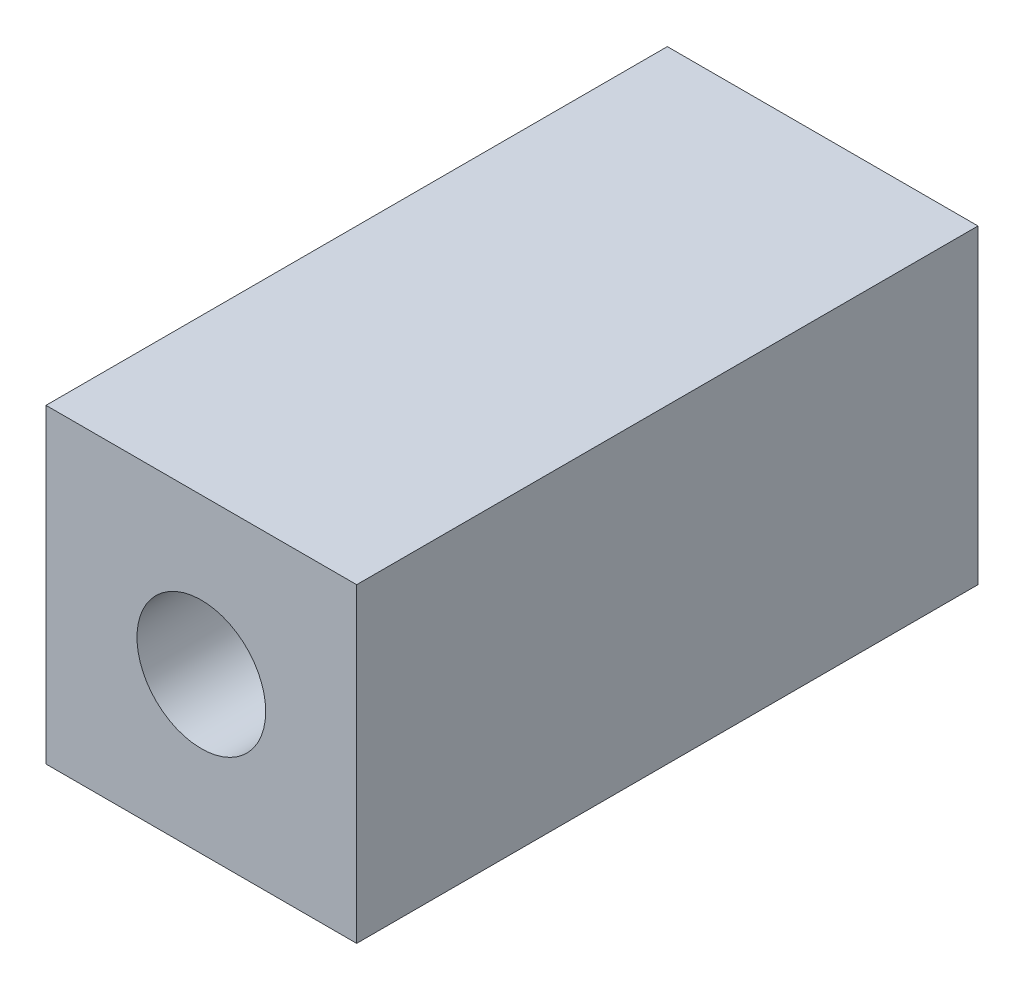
SolidWorks part; units mm, degrees
ref_plane "Plan de face" through (0, 0, 0) normal (0, 0, 1) x (1, 0, 0)
ref_plane "Plan de dessus" through (0, 0, 0) normal (0, 1, 0) x (1, 0, 0)
ref_plane "Plan de droite" through (0, 0, 0) normal (1, 0, 0) x (0, 0, -1)
sketch "Esquisse1" plane through (0, 0, 0) normal (0, 0, 1) x (1, 0, 0)
  line L1 (0, 0) -> (35, 0)
  line L2 (0, 0) -> (0, 35)
  line L3 (0, 35) -> (35, 35)
  line L4 (35, 0) -> (35, 35)
  dimension "D1" = 35
  dimension "D2" = 35
extrude "Extrusion1" add sketch "Esquisse1" along normal blind 70
hole_wizard "Trou taraudé M16x1.51" positions "Esquisse3" profile "Esquisse2" tap size "M16x1.5" standard "ISO"
sketch "Esquisse3" plane through (0, 0, 70) normal (0, 0, 1) x (1, 0, 0)
  line L0 (35, 35) -> (0, 35) construction
  line L1 (35, 0) -> (35, 35) construction
  point P0 (17.5, 17.5)
  dimension "D1" = 17.5
  dimension "D2" = 17.5
sketch "Esquisse2" plane through (17.5, 17.5, 70) normal (1, 0, 0) x (0, -1, 0)
  line L0 (0, 0) -> (0, 55.8562)
  line L1 (0, 55.8562) -> (7.25, 51.5)
  line L2 (7.25, 51.5) -> (7.25, 0)
  line L5 (7.25, 0) -> (0, 0)
  line L10 (0, 55.8562) -> (-7.25, 51.5) construction
  line L11 (0, -6.35) -> (0, 107.95) construction
  dimension "Diamètre du trou pour taraudage" = 14.5
  dimension "Profondeur du trou pour taraudage" = 51.5
  dimension "Angle de pointe" = 118
